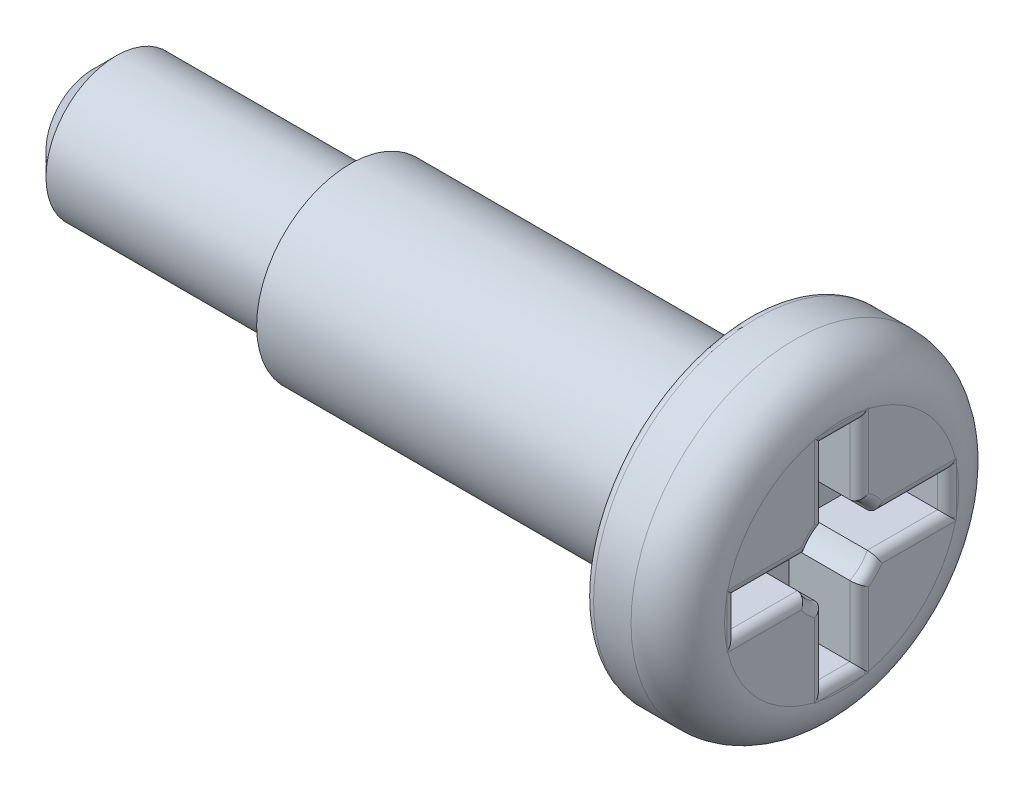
SolidWorks part; units mm, degrees
ref_plane "Face" through (0, 0, 0) normal (0, 0, 1) x (1, 0, 0)
ref_plane "Dessus" through (0, 0, 0) normal (0, 1, 0) x (1, 0, 0)
ref_plane "Droite" through (0, 0, 0) normal (1, 0, 0) x (0, 0, -1)
sketch "Esquisse1" plane through (0, 0, 0) normal (0, 0, 1) x (1, 0, 0)
  line L0 (0, 0) -> (5, 0) construction
  line L1 (0, 0) -> (0, 1.5)
  line L2 (0, 1.5) -> (5.5, 1.5)
  line L3 (14, 2) -> (14, 3.5)
  line L4 (14, 3.5) -> (15, 3.5)
  line L5 (16, 2.5) -> (16, 0)
  line L6 (0, 0) -> (16, 0)
  line L7 (5.5, 1.5) -> (5.5, 2)
  line L8 (5.5, 2) -> (14, 2)
  arc A0 (15, 3.5) -> (16, 2.5) centre (15, 2.5) cw
  point P10 (16, 3.5)
  dimension "D5" = 1
  dimension "D1" = 3
  dimension "D2" = 2
  dimension "D3" = 2
  dimension "D4" = 7
  dimension "D6" = 8.5
revolve "Révolution1" add sketch "Esquisse1" angle 360 about L0
sketch "Esquisse2" plane through (16, 0, 0) normal (1, 0, 0) x (0, 0, -1)
  line L0 (0, 0) -> (0, 2.6874) construction
  line L1 (0.375, 0) -> (-0.375, 0)
  line L2 (-0.375, 0) -> (-0.375, 2.25)
  line L3 (0.375, 0) -> (0.375, 2.25)
  line L4 (-0.375, 2.25) -> (0.375, 2.25)
  point P8 (0, 2.25)
  dimension "D1" = 0.75
  dimension "D2" = 2.25
extrude "Enlèv. mat.-Extru.1" cut sketch "Esquisse2" against normal blind 1.5
pattern_circular "Répétition circulaire1" count 4 over 360 about axis through (0, 0, 0) along (1, 0, 0)
sketch "Esquisse3" plane through (16, 0, 0) normal (1, 0, 0) x (0, 0, -1)
  circle A0 centre (0, 0) radius 0.8365
extrude "Enlèv. mat.-Extru.2" cut sketch "Esquisse3" against normal up to surface (1.5 mm away)
fillet "Congé2" radius 0.2
chamfer "Chanfrein1" distance 0.5 angle 45
